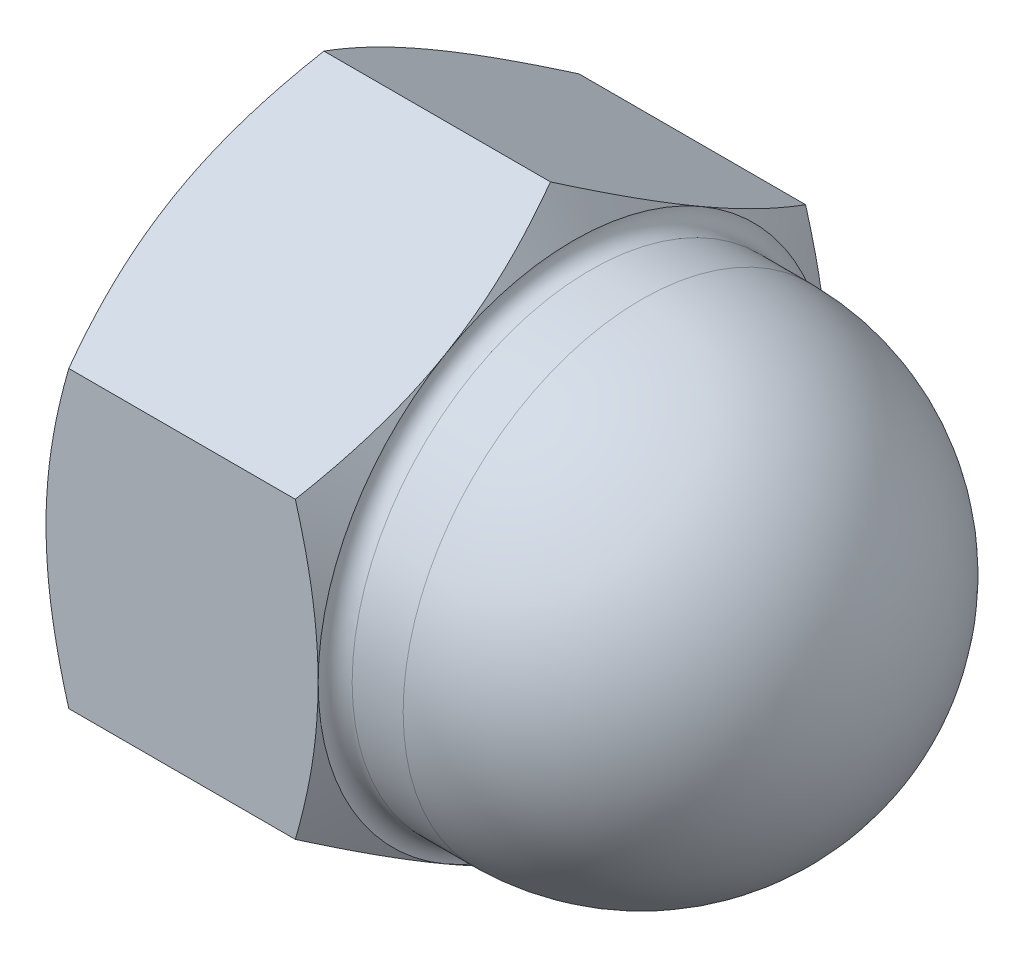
SolidWorks part; units mm, degrees
ref_plane "Plane1" through (0, 0, 0) normal (0, 0, 1) x (1, 0, 0)
ref_plane "Plane2" through (0, 0, 0) normal (0, 1, 0) x (1, 0, 0)
ref_plane "Plane3" through (0, 0, 0) normal (1, 0, 0) x (0, 0, -1)
sketch "BaseNutSke" plane through (0, 0, 0) normal (1, 0, 0) x (0, 0, -1)
  line L6 (15, 8.6603) -> (15, -8.6603)
  line L7 (-15, 8.6603) -> (-15, -8.6603)
  line L8 (15, 8.6603) -> (0, 17.3205)
  line L9 (0, 17.3205) -> (-15, 8.6603)
  line L10 (-15, -8.6603) -> (0, -17.3205)
  line L11 (0, -17.3205) -> (15, -8.6603)
  dimension "D4" = 60
  dimension "D1" = 120
  dimension "D2" = 15
  dimension "D3" = 15
  dimension "Width_flats" = 30
extrude "BaseNut" add sketch "BaseNutSke" along normal blind 16
sketch "DomeSke" plane through (0, 0, 0) normal (0, 0, 1) x (1, 0, 0)
  line L0 (0, 0) -> (63.5, 0) construction
  line L1 (0, 8.6603) -> (0, -8.6603) construction
  line L2 (34, 0) -> (0, 0)
  line L3 (0, 14) -> (20, 14)
  line L4 (0, -14) -> (22.225, -14) construction
  line L5 (0, 14) -> (0, 0)
  arc A0 (20, 14) -> (34, 0) centre (20, 0) cw
  dimension "Dome_rad" = 14
  dimension "Overall_ht" = 34
revolve "Dome" add sketch "DomeSke" angle 360 about L0
sketch "Sketch4" plane through (0, 0, 0) normal (0, 0, 1) x (1, 0, 0)
  line L0 (0, 15) -> (2.7831, 19.8205)
  line L1 (16, 15) -> (13.2169, 19.8205)
  line L2 (2.7831, 19.8205) -> (13.2169, 19.8205)
  line L3 (16, 15) -> (18, 15)
  line L4 (18, 15) -> (18, 30)
  line L5 (18, 30) -> (-2, 30)
  line L6 (0, 15) -> (-2, 15)
  line L7 (-2, 15) -> (-2, 30)
  line L8 (16, 17.3205) -> (16, 8.6603) construction
  line L9 (0, 17.3205) -> (0, 8.6603) construction
  line L10 (0, 0) -> (57.15, 0) construction
  line L11 (16, 17.3205) -> (0, 17.3205) construction
  point P17 (16, 15)
  dimension "D1" = 30
  dimension "D2" = 30
  dimension "D3" = 2
  dimension "D4" = 2
  dimension "D5" = 2.5
  dimension "D6" = 15
  dimension "D7" = 15
revolve "DoubleChamfer" cut sketch "Sketch4" angle 360 about L10
sketch "TapDriSke" plane through (0, 0, 0) normal (0, 0, 1) x (1, 0, 0)
  line L0 (0, 0) -> (44.45, 0) construction
  line L1 (0, 8.75) -> (23, 8.75)
  line L2 (0, 12.9904) -> (0, 0) construction
  line L3 (23, 8.75) -> (28.2575, 0)
  line L4 (0, 0) -> (63.5, 0) construction
  line L5 (28.2575, 0) -> (0, 0)
  line L6 (0, 0) -> (0, 8.75)
  line L7 (23, -8.75) -> (28.2575, 0) construction
  line L8 (0, -8.75) -> (23, -8.75) construction
  line L9 (2.5, 6.35) -> (2.5, 3.175) construction
  dimension "TPA" = 118
  dimension "Thread_min" = 17.5
  dimension "Drill_depth" = 23
  dimension "Drill_clr" = 5
revolve "TapDrill" cut sketch "TapDriSke"
revolve "EndChamfer" cut sketch "EndChamferSketch" angle 360 about L4
sketch "EndChamferSketch" plane through (0, 0, 0) normal (0, 0, 1) x (1, 0, 0)
  line L0 (-0.0254, 10) -> (0.0254, 10)
  line L1 (0.0254, 10) -> (0.9882, 8.625)
  line L2 (0.9882, 8.625) -> (-0.0254, 8.625)
  line L3 (-0.0254, 8.625) -> (-0.0254, 10)
  line L4 (0, 0) -> (-15.875, 0) construction
  dimension "D1" = 0.0508
  dimension "D2" = 35
  dimension "D3" = 0.0254
  dimension "ChamferDepth" = 1.375
  dimension "ThreadMajor" = 10
revolve "Undercut" cut sketch "UcutSke" angle 360 about L0
sketch "UcutSke" plane through (0, 0, 0) normal (0, 0, 1) x (1, 0, 0)
  line L0 (0, 0) -> (38.1, 0) construction
  line L1 (17.8994, 10.1) -> (17.12, 8.75)
  line L2 (17.12, 0.25) -> (26.42, 0.25)
  line L3 (26.42, 0.25) -> (26.42, 10.1)
  line L4 (26.42, 10.1) -> (17.8994, 10.1)
  line L5 (17.12, 0.25) -> (17.12, 8.75)
  line L6 (23, 8.75) -> (0, 8.75) construction
  line L7 (0, 12.9904) -> (0, 0) construction
  dimension "D1" = 0.5
  dimension "D2" = 240
  dimension "Ucut_dia" = 20.2
  dimension "Ucut_dep" = 26.42
  dimension "Ucut_wid" = 9.3
sketch "ThdSchSke" plane through (0, 0, 0) normal (0, 1, 0) x (1, 0, 0)
  line L0 (0.0381, 10) -> (-0.8372, 8.75)
  line L1 (-0.8372, 8.75) -> (-0.8372, 4.375)
  line L2 (-0.8372, 4.375) -> (0.9134, 4.375)
  line L3 (0.9134, 4.375) -> (0.9134, 8.75)
  line L4 (0.9134, 8.75) -> (0.0381, 10)
  line L5 (-38.1, 0) -> (3.175, 0) construction
  line L6 (0, 0) -> (-15.875, 0) construction
  line L7 (0, 0) -> (63.5, 0) construction
  line L9 (2.5381, 0.475) -> (2.5381, -5.875) construction
  dimension "D1" = 0.0381
  dimension "VeeAngle" = 70
  dimension "SideAngle" = 55
  dimension "Thread_major" = 20
  dimension "Tap_drill" = 17.5
  dimension "OverCut" = 8.75
  dimension "Advance" = 2.5
revolve "ThreadSchematic" [suppressed] cut sketch "ThdSchSke" angle 360 about L5
pattern_linear "ThdSchPat" [suppressed]
fillet "DomeFillet" radius 1 1 edges at (16, 0, 14)
equation "' \"Width_flats@BaseNutSke\" = 30"
equation "' \"Hex_ht@BaseNut\" = 16"
equation "' \"Overall_ht@DomeSke\" = 34"
equation "' \"Dome_rad@DomeSke\" = 14"
equation "' \"Thread_min@TapDriSke\" = 17.5"
equation "' \"Drill_clr@TapDriSke\" = 5.0"
equation "' \"Advance@ThdSchSke\" = 2.5"
equation "' \"Thread_nominal@ThreadCosmetic\" = 20"
equation "' \"Radius@DomeFillet\" = 0.5"
equation "' \"Ucut_wid@UcutSke\" = 9.3"
equation "' \"Ucut_dep@UcutSke\" = 26.42"
equation "\"Drill_depth@TapDriSke\" = \"Overall_ht@DomeSke\"  - \"Drill_clr@TapDriSke\" - 0.3 * \"Thread_nominal@ThreadCosmetic\""
equation "\"Ucut_dia@UcutSke\" = \"Thread_nominal@ThreadCosmetic\" * 1.01"
equation "\"Thread_depth@ThreadCosmetic\" = \"Ucut_dep@UcutSke\" - \"Ucut_wid@UcutSke\" + ( \"Thread_nominal@ThreadCosmetic\" - \"Thread_min@TapDriSke\" ) / 2 * 0.57735"
equation "\"D2@BaseNutSke\" = \"Width_flats@BaseNutSke\" / 2"
equation "\"D3@BaseNutSke\" = \"Width_flats@BaseNutSke\" / 2"
equation "\"D7@Sketch4\" = \"Width_flats@BaseNutSke\" / 2"
equation "\"D5@Sketch4\" = \"Width_flats@BaseNutSke\" / 12"
equation "\"Thread_major@ThdSchSke\" = \"Thread_nominal@ThreadCosmetic\""
equation "\"Tap_drill@ThdSchSke\" = \"Thread_min@TapDriSke\""
equation "\"Overcut@ThdSchSke\" = \"Tap_drill@ThdSchSke\" * 0.5"
equation "\"Num_threads@ThdSchPat\" = int(  ( \"Thread_depth@ThreadCosmetic\" - 0.002 ) / \"Advance@ThdSchSke\" + 0.999 )  + 1"
equation "\"Advance@ThdSchPat\" = ( \"Thread_depth@ThreadCosmetic\" - 0.002 ) /  (\"Num_threads@ThdSchPat\" - 1) 'relax it"
equation "\"ThreadMajor@EndChamferSketch\" = \"Thread_nominal@ThreadCosmetic\" * 0.5"
equation "\"ChamferDepth@EndChamferSketch\" = (\"Thread_nominal@ThreadCosmetic\" - \"Thread_min@TapDriSke\") * 0.55"
